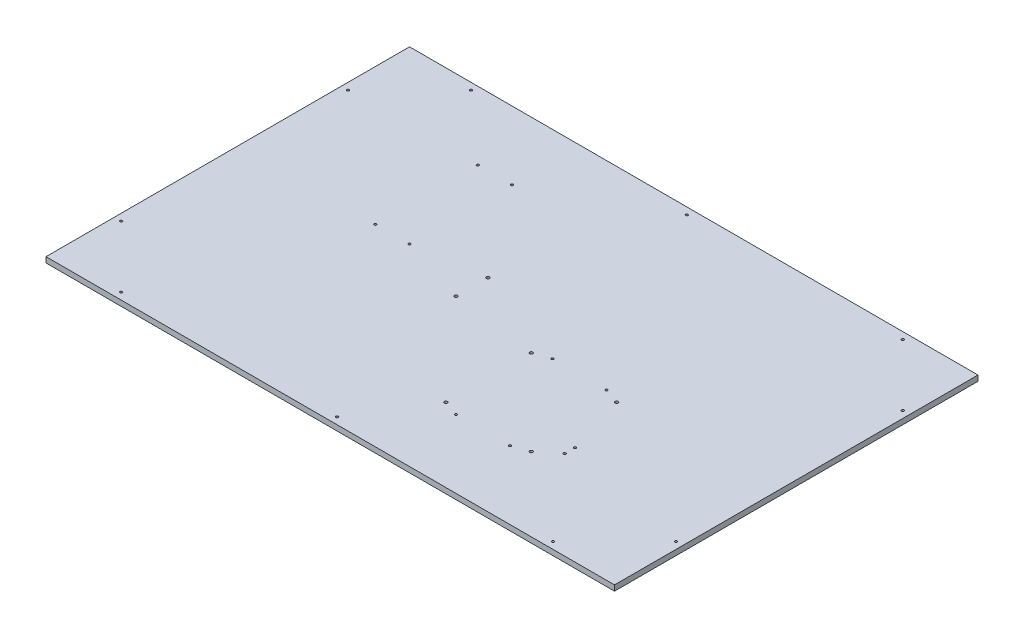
SolidWorks part; units mm, degrees
ref_plane "Ebene vorne" through (0, 0, 0) normal (0, 0, 1) x (1, 0, 0)
ref_plane "Ebene oben" through (0, 0, 0) normal (0, 1, 0) x (1, 0, 0)
ref_plane "Ebene rechts" through (0, 0, 0) normal (1, 0, 0) x (0, 0, -1)
sketch "Skizze1" plane through (0, 0, 0) normal (0, 1, 0) x (1, 0, 0)
  line L1 (-416, -266) -> (416, -266)
  line L2 (-416, -266) -> (-416, 266)
  line L3 (-416, 266) -> (416, 266)
  line L4 (416, -266) -> (416, 266)
  line L5 (-416, -266) -> (416, 266) construction
  line L6 (-416, 266) -> (416, -266) construction
  point P0 (0, 0)
  dimension "D1" = 832
  dimension "D2" = 532
extrude "Aufsatz-Linear austragen1" add sketch "Skizze1" along normal blind 8
hole_wizard "Ø3.5 (3.5) Durchmesser Bohrung1" positions "Skizze2" profile "Skizze3" hole size "Ø3.5" standard "DIN"
sketch "Skizze2" plane through (0, 8, 0) normal (0, 1, 0) x (1, 0, 0)
  line L0 (416, 266) -> (-416, 266) construction
  line L1 (-416, 266) -> (-416, -266) construction
  line L2 (-416, -266) -> (416, -266) construction
  point P0 (-216, 166)
  point P2 (-166, 166)
  point P4 (-166, 16)
  point P6 (-216, 16)
  point P13 (84, -24.8)
  point P15 (163.1, -24.8)
  point P17 (163.1, -166)
  point P19 (84, -166)
  dimension "D1" = 50
  dimension "D2" = 150
  dimension "D3" = 100
  dimension "D4" = 200
  dimension "D5" = 79.1
  dimension "D6" = 141.2
  dimension "D7" = 100
  dimension "D8" = 500
sketch "Skizze3" plane through (-216, 8, -166) normal (1, 0, 0) x (0, 0, 1)
  line L0 (0, 0) -> (0, 8)
  line L1 (0, 8) -> (1.75, 8)
  line L2 (1.75, 8) -> (1.75, 0)
  line L5 (1.75, 0) -> (0, 0)
  line L11 (0, -6.35) -> (0, 107.95) construction
  dimension "Bohrerdurchmesser" = 3.5
  dimension "Bohrungstiefe" = 8
hole_wizard "Ø4.5 (4.5) Durchmesser Bohrung1" positions "Skizze4" profile "Skizze5" hole size "Ø4.5" standard "DIN"
sketch "Skizze4" plane through (0, 8, 0) normal (0, 1, 0) x (1, 0, 0)
  line L0 (84, -166) -> (163.1, -166) construction
  line L2 (84, -24.8) -> (163.1, -24.8) construction
  line L4 (123.55, -24.8) -> (123.55, -166) construction
  line L5 (-416, 266) -> (-416, -266) construction
  line L6 (-416, -266) -> (416, -266) construction
  point P0 (61.05, -32.9)
  point P2 (186.05, -32.9)
  point P4 (186.05, -157.9)
  point P6 (61.05, -157.9)
  point P25 (123.55, -95.4)
  point P26 (-66, 30.75)
  point P28 (-66, -16)
  dimension "D1" = 62.5
  dimension "D2" = 62.5
  dimension "D3" = 62.5
  dimension "D4" = 62.5
  dimension "D5" = 46.75
  dimension "D6" = 350
  dimension "D7" = 250
sketch "Skizze5" plane through (61.05, 8, 32.9) normal (1, 0, 0) x (0, 0, 1)
  line L0 (0, 0) -> (0, 8)
  line L1 (0, 8) -> (2.25, 8)
  line L2 (2.25, 8) -> (2.25, 0)
  line L5 (2.25, 0) -> (0, 0)
  line L11 (0, -6.35) -> (0, 107.95) construction
  dimension "Bohrerdurchmesser" = 4.5
  dimension "Bohrungstiefe" = 8
hole_wizard "Ø3.5 (3.5) Durchmesser Bohrung2" positions "Skizze6" profile "Skizze7" hole size "Ø3.5" standard "DIN"
sketch "Skizze6" plane through (0, 8, 0) normal (0, 1, 0) x (1, 0, 0)
  circle A0 centre (163.1, -166) radius 1.75 construction
  point P0 (213.1, -136)
  point P2 (213.1, -121)
  dimension "D2" = 50
  dimension "D3" = 30
  dimension "D1" = 15
sketch "Skizze7" plane through (213.1, 8, 136) normal (1, 0, 0) x (0, 0, 1)
  line L0 (0, 0) -> (0, 8)
  line L1 (0, 8) -> (1.75, 8)
  line L2 (1.75, 8) -> (1.75, 0)
  line L5 (1.75, 0) -> (0, 0)
  line L11 (0, -6.35) -> (0, 107.95) construction
  dimension "Bohrerdurchmesser" = 3.5
  dimension "Bohrungstiefe" = 8
hole_wizard "Ø3.5 (3.5) Durchmesser Bohrung3" positions "Skizze8" profile "Skizze9" hole size "Ø3.5" standard "DIN"
sketch "Skizze8" plane through (0, 8, 0) normal (0, 1, 0) x (1, 0, 0)
  line L0 (416, 266) -> (-416, 266) construction
  line L1 (-416, -266) -> (416, -266) construction
  line L2 (-416, 266) -> (-416, -266) construction
  line L3 (416, -266) -> (416, 266) construction
  point P0 (-406, 166)
  point P2 (-406, -166)
  point P4 (-316, -256)
  point P6 (0, -256)
  point P8 (316, -256)
  point P10 (406, -166)
  point P12 (406, 166)
  point P14 (316, 256)
  point P16 (0, 256)
  point P18 (-316, 256)
  dimension "D1" = 10
  dimension "D2" = 10
  dimension "D3" = 100
  dimension "D4" = 100
  dimension "D5" = 10
  dimension "D6" = 100
  dimension "D7" = 100
  dimension "D8" = 10
sketch "Skizze9" plane through (-406, 8, -166) normal (1, 0, 0) x (0, 0, 1)
  line L0 (0, 0) -> (0, 8)
  line L1 (0, 8) -> (1.75, 8)
  line L2 (1.75, 8) -> (1.75, 0)
  line L5 (1.75, 0) -> (0, 0)
  line L11 (0, -6.35) -> (0, 107.95) construction
  dimension "Bohrerdurchmesser" = 3.5
  dimension "Bohrungstiefe" = 8
chamfer "Fase1" distance 1.5 angle 45 20 edges at (213.1, 0, 122.75) (213.1, 0, 137.75) (163.1, 0, 26.55) (84, 0, 26.55) (163.1, 0, 167.75) (84, 0, 167.75) (-166, 0, -164.25) (-216, 0, -164.25) (-166, 0, -14.25) (-216, 0, -14.25) (0, 0, 257.75) (316, 0, 257.75) (406, 0, 167.75) (406, 0, -164.25) (316, 0, -254.25) (0, 0, -254.25) (-316, 0, -254.25) (-406, 0, -164.25) (-406, 0, 167.75) (-316, 0, 257.75)
chamfer "Fase2" distance 2.5 angle 45 6 edges at (186.05, 0, 35.15) (186.05, 0, 160.15) (61.05, 0, 160.15) (61.05, 0, 35.15) (-66, 0, 18.25) (-66, 0, -28.5)
